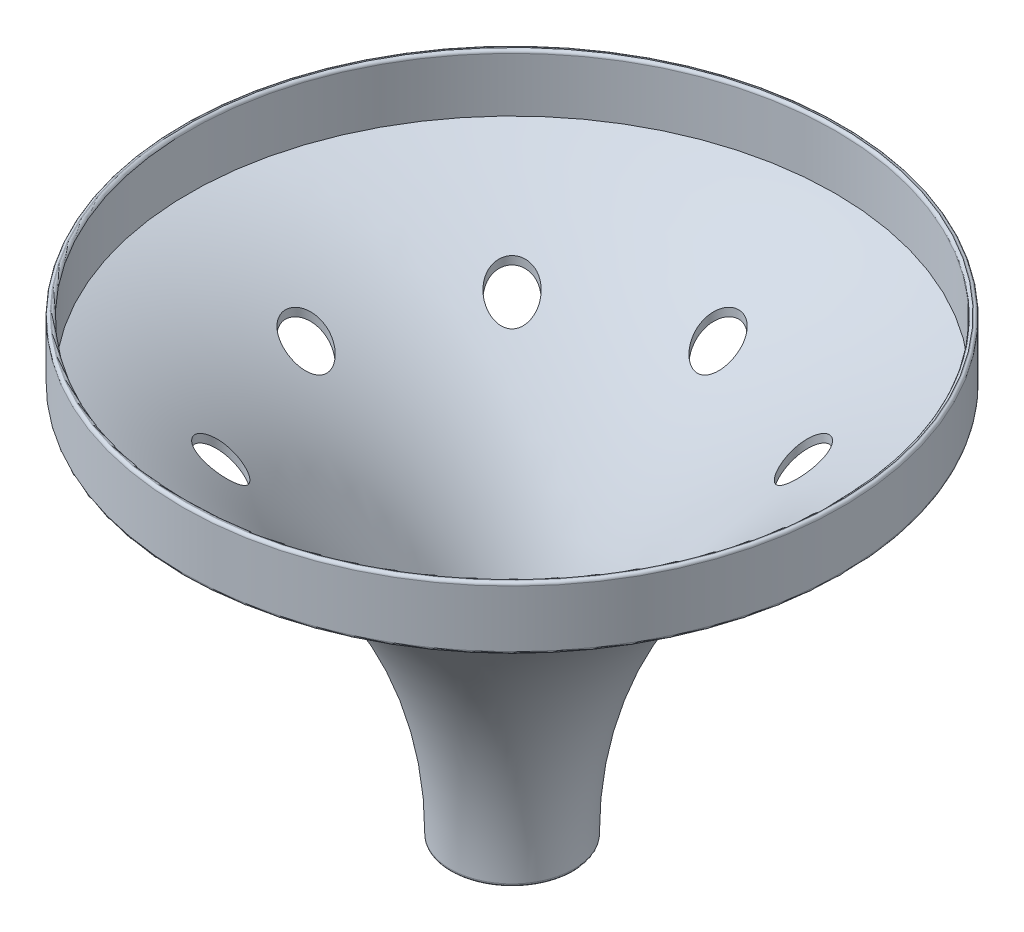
SolidWorks part; units mm, degrees
ref_plane "Front Plane" through (0, 0, 0) normal (0, 0, 1) x (1, 0, 0)
ref_plane "Top Plane" through (0, 0, 0) normal (0, 1, 0) x (1, 0, 0)
ref_plane "Right Plane" through (0, 0, 0) normal (1, 0, 0) x (0, 0, -1)
sketch "Sketch1" plane through (0, 0, 0) normal (0, 0, 1) x (1, 0, 0)
  line L0 (0, 0) -> (0, 56.2568) construction
  line L1 (0, 69.85) -> (50.8, 69.85)
  line L2 (0, 0) -> (9.525, 0)
  line L3 (50.8, 69.85) -> (50.8, 60.325)
  line L4 (0, 69.85) -> (0, 0)
  arc A0 (50.8, 60.325) -> (9.525, 0) centre (73.0195, 0.8393) ccw
  dimension "Side RAD" = 63.5
  dimension "Upper DIA" = 101.6
  dimension "Height DIM" = 69.85
  dimension "Side Step" = 9.525
  dimension "Lower DIA" = 19.05
revolve "Revolve1" add sketch "Sketch1" angle 360 about L0
shell "Shell1" thickness 1.016
sketch "Sketch2" plane through (0, 0, 0) normal (0, 1, 0) x (1, 0, 0)
  circle A0 centre (0, 0) radius 31.75 construction
  circle A1 centre (0, 31.75) radius 3.175
  dimension "D1" = 63.5
  dimension "D2" = 6.35
extrude "Cut-Extrude1" cut sketch "Sketch2" along normal through all
pattern_circular "CirPattern1" count 8 over 360 about axis through (0, 0, 0) along (0, 1, 0) of "Cut-Extrude1"
fillet "Fillet1" radius 0.4572 5 edges at (0, 69.85, -50.8) (0, 0, -9.525) (0, 0, 8.5089) (0, 60.325, -50.8) (0, 69.85, 49.784)
